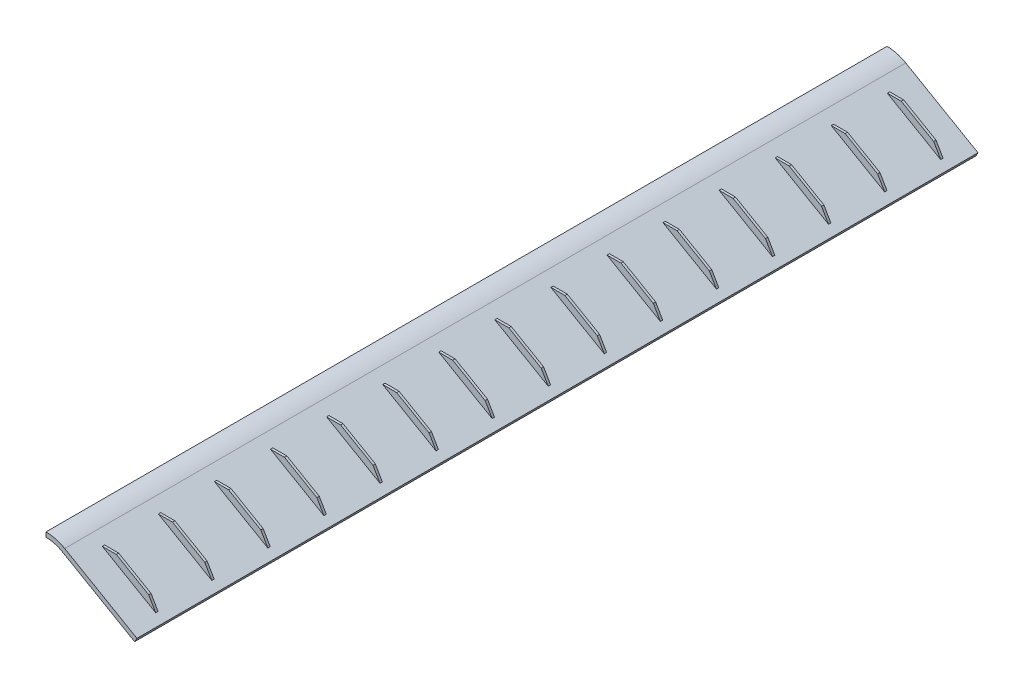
SolidWorks part; units mm, degrees
ref_plane "Face" through (0, 0, 0) normal (0, 0, 1) x (1, 0, 0)
ref_plane "Dessus" through (0, 0, 0) normal (0, 1, 0) x (1, 0, 0)
ref_plane "Droite" through (0, 0, 0) normal (1, 0, 0) x (0, 0, -1)
sketch "Esquisse1" plane through (0, 0, 0) normal (0, 0, 1) x (1, 0, 0)
  line L0 (4, -1.0718) -> (19.4641, -10)
  line L1 (0, -8) -> (4, -1.0718) construction
  line L2 (0, -8) -> (0, 0) construction
  arc A0 (0, 0) -> (4, -1.0718) centre (0, -8) cw
  dimension "D3" = 8
  dimension "D1" = 30
  dimension "D2" = 10
extrude "Extru.-Mince1" add sketch "Esquisse1" along normal mid plane 180 thin
sketch "Esquisse2" plane through (0, 0, 0) normal (0, 0, 1) x (1, 0, 0)
  line L0 (6.3038, -2.4019) -> (9.3038, -2.4019)
  line L1 (4, -1.0718) -> (19.4641, -10) construction
  line L2 (9.3038, -2.4019) -> (16.2321, -6.4019)
  line L3 (16.2321, -6.4019) -> (17.7321, -9)
  line L4 (6.3038, -2.4019) -> (17.7321, -9)
  line L5 (19.4641, -10) -> (18.9641, -10.866) construction
  line L6 (12.0179, -5.701) -> (12.7679, -4.4019) construction
  dimension "D1" = 1.5
  dimension "D2" = 8
  dimension "D3" = 2
extrude "Extrusion1" add sketch "Esquisse2" along normal mid plane 0.5
pattern_linear "Répétition linéaire1" count 8 spacing 12
mirror "Symétrie1" about plane through (0, 0, 0) normal (0, 0, 1)
